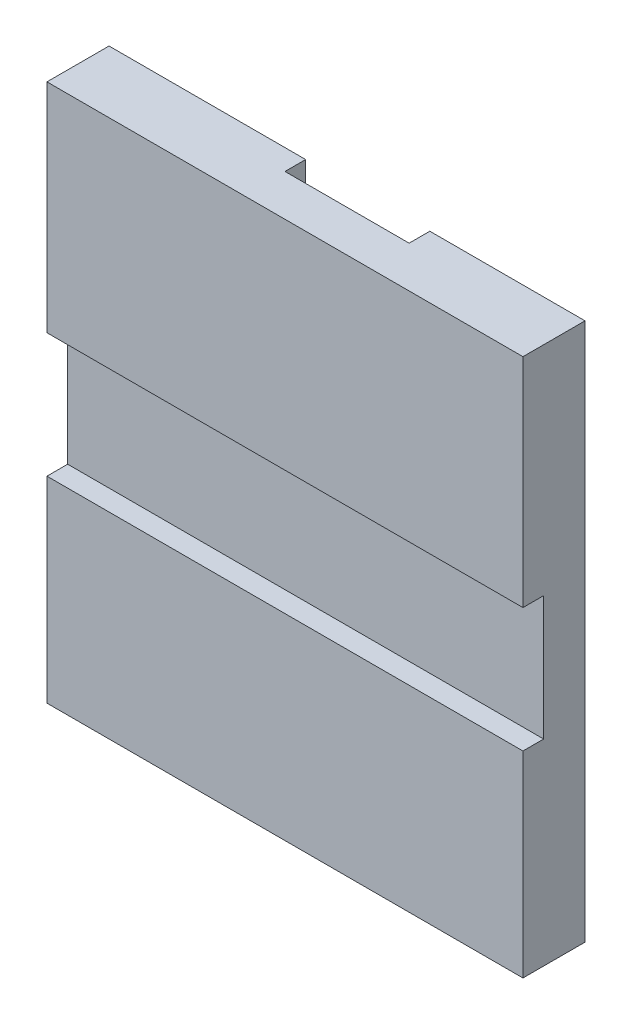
SolidWorks part; units mm, degrees
ref_plane "Plan de face" through (0, 0, 0) normal (0, 0, 1) x (1, 0, 0)
ref_plane "Plan de dessus" through (0, 0, 0) normal (0, 1, 0) x (1, 0, 0)
ref_plane "Plan de droite" through (0, 0, 0) normal (1, 0, 0) x (0, 0, -1)
sketch "Esquisse1" plane through (0, 0, 0) normal (0, 0, 1) x (1, 0, 0)
  line L1 (0, 0) -> (460, 0)
  line L2 (0, 0) -> (0, 520)
  line L3 (0, 520) -> (460, 520)
  line L4 (460, 0) -> (460, 520)
  dimension "D1" = 460
  dimension "D2" = 520
extrude "Extrusion1" add sketch "Esquisse1" along normal blind 60
sketch "Esquisse2" plane through (0, 0, 0) normal (0, 0, -1) x (-1, 0, 0)
  line L0 (-460, 520) -> (0, 520) construction
  line L1 (-310, 520) -> (-190, 520)
  line L2 (-310, 520) -> (-310, 0)
  line L3 (-310, 0) -> (-190, 0)
  line L4 (-190, 520) -> (-190, 0)
  line L5 (0, 520) -> (0, 0) construction
  dimension "D1" = 120
  dimension "D2" = 190
extrude "Enlèv. mat.-Extru.1" cut sketch "Esquisse2" against normal blind 20
sketch "Esquisse3" plane through (0, 0, 60) normal (0, 0, 1) x (1, 0, 0)
  line L0 (0, 520) -> (0, 0) construction
  line L1 (0, 310) -> (460, 310)
  line L2 (0, 310) -> (0, 190)
  line L3 (0, 190) -> (460, 190)
  line L4 (460, 310) -> (460, 190)
  line L5 (460, 0) -> (460, 520) construction
  line L6 (0, 0) -> (460, 0) construction
  dimension "D1" = 120
  dimension "D2" = 190
extrude "Enlèv. mat.-Extru.2" cut sketch "Esquisse3" against normal blind 20
